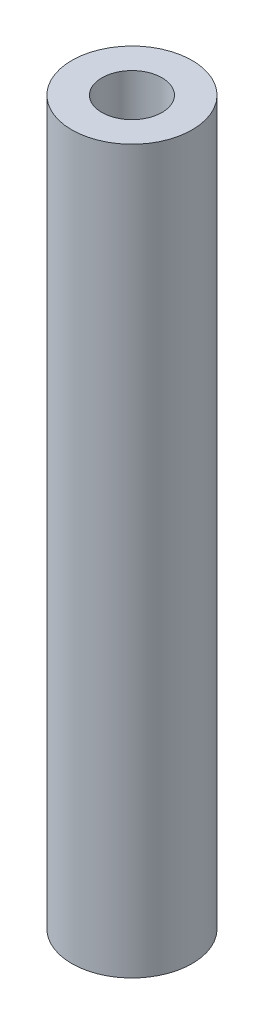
SolidWorks part; units mm, degrees
ref_plane "Płaszczyzna przednia" through (0, 0, 0) normal (0, 0, 1) x (1, 0, 0)
ref_plane "Płaszczyzna górna" through (0, 0, 0) normal (0, 1, 0) x (1, 0, 0)
ref_plane "Płaszczyzna prawa" through (0, 0, 0) normal (1, 0, 0) x (0, 0, -1)
sketch "Szkic1" plane through (0, 0, 0) normal (0, 1, 0) x (1, 0, 0)
  circle A0 centre (0, 0) radius 2.5
  circle A1 centre (0, 0) radius 5
  dimension "D1" = 5
  dimension "D2" = 10
extrude "Dodanie-wyciągnięcie1" add sketch "Szkic1" along normal blind 60
